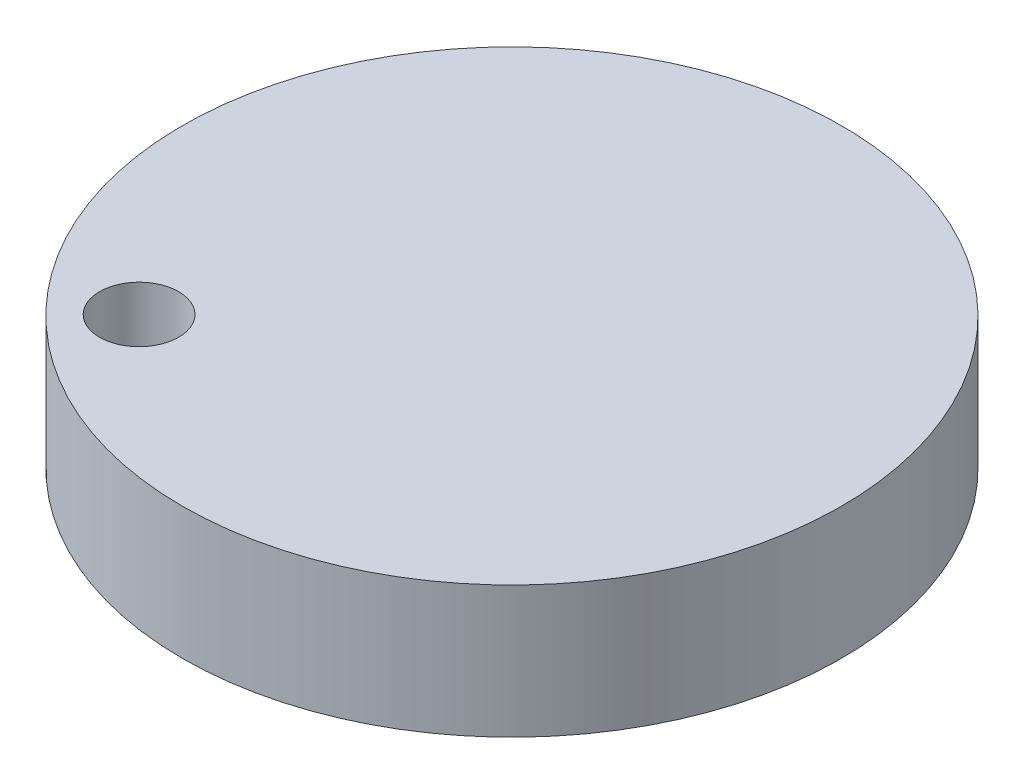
SolidWorks part; units mm, degrees
ref_plane "Front Plane" through (0, 0, 0) normal (0, 0, 1) x (1, 0, 0)
ref_plane "Top Plane" through (0, 0, 0) normal (0, 1, 0) x (1, 0, 0)
ref_plane "Right Plane" through (0, 0, 0) normal (1, 0, 0) x (0, 0, -1)
sketch "Sketch1" plane through (0, 0, 0) normal (0, 1, 0) x (1, 0, 0)
  circle A0 centre (0, 0) radius 12.5
  dimension "D1" = 25
extrude "Boss-Extrude1" add sketch "Sketch1" along normal blind 5
sketch "Sketch5" plane through (0, 0, 0) normal (0, -1, 0) x (1, 0, 0)
  line L0 (85.3333, 256) -> (426.6667, 256) construction
  line L1 (70.3333, 241) -> (411.6667, 241) construction
  line L20 (15.5994, -12.313) -> (15.5994, 14.2765) construction
  line L22 (-1.245, 0.1172) -> (0.0322, 3.1231)
  line L23 (1.5772, 0.1172) -> (0.0322, 3.1231)
  line L24 (0.0322, 3.1231) -> (1.5772, 0.1172)
  line L25 (-6.1218, -4.2841) -> (-6.614, -5.5378)
  line L26 (-3.2456, -2.8517) -> (-3.2003, -2.4439)
  line L27 (3.6668, 0.4484) -> (0.1519, 8.6268)
  line L28 (8.8353, -7.3566) -> (6.3322, -5.7535)
  line L29 (8.8353, -7.8036) -> (8.8353, -7.3566)
  line L30 (4.3982, -7.8036) -> (8.8353, -7.8036)
  line L31 (4.5863, -6.9096) -> (4.3982, -7.8036)
  line L32 (0.0322, 5.79) -> (2.5395, -1.2019)
  line L33 (-3.2003, -2.4439) -> (0.0322, 5.79)
  line L34 (-3.7831, -7.6989) -> (-3.6565, -6.5577)
  line L35 (-3.7831, -7.9389) -> (-3.7831, -7.6989)
  line L36 (-9.1214, -7.9389) -> (-3.7831, -7.9389)
  line L37 (-9.1214, -7.4584) -> (-9.1214, -7.9389)
  line L38 (-6.614, -5.5378) -> (-9.1214, -7.4584)
  line L39 (-0.9506, 8.8879) -> (-5.2069, -1.9539)
  arc A5 (1.5772, 0.1172) -> (-1.245, 0.1172) centre (0.1661, -0.1371) cw
  arc A6 (-0.9506, 8.8879) -> (-7.728, 2.3014) centre (-1.4867, 2.6593) cw
  arc A7 (0.1519, 9.24) -> (-7.728, 0.1172) centre (0.7835, 0.7298) cw
  arc A8 (0.1519, 9.24) -> (-7.728, 0.1172) centre (-0.8426, 2.1345) cw
  arc A9 (-0.9506, 8.8879) -> (-7.728, 2.3014) centre (-1.7737, 2.9547) cw
extrude "Boss-Extrude2" add sketch "Sketch5" along normal blind 2 contours A7 A8 | L34 A7 L25 L38 L37 L36 L35 | L28 A7 L31 L30 L29 | A9 A6 | A9 L26 L33 L32 L27 L39 | A5 L23 L22
sketch "Sketch7" plane through (0, 0, 0) normal (0, -1, 0) x (1, 0, 0)
  circle A0 centre (-7.1192, 7.0226) radius 1.5
  circle A1 centre (0, 0) radius 12.5 construction
  dimension "D2" = 3
  dimension "D1" = 10
extrude "Cut-Extrude1" cut sketch "Sketch7" against normal through all both and the other way through all
